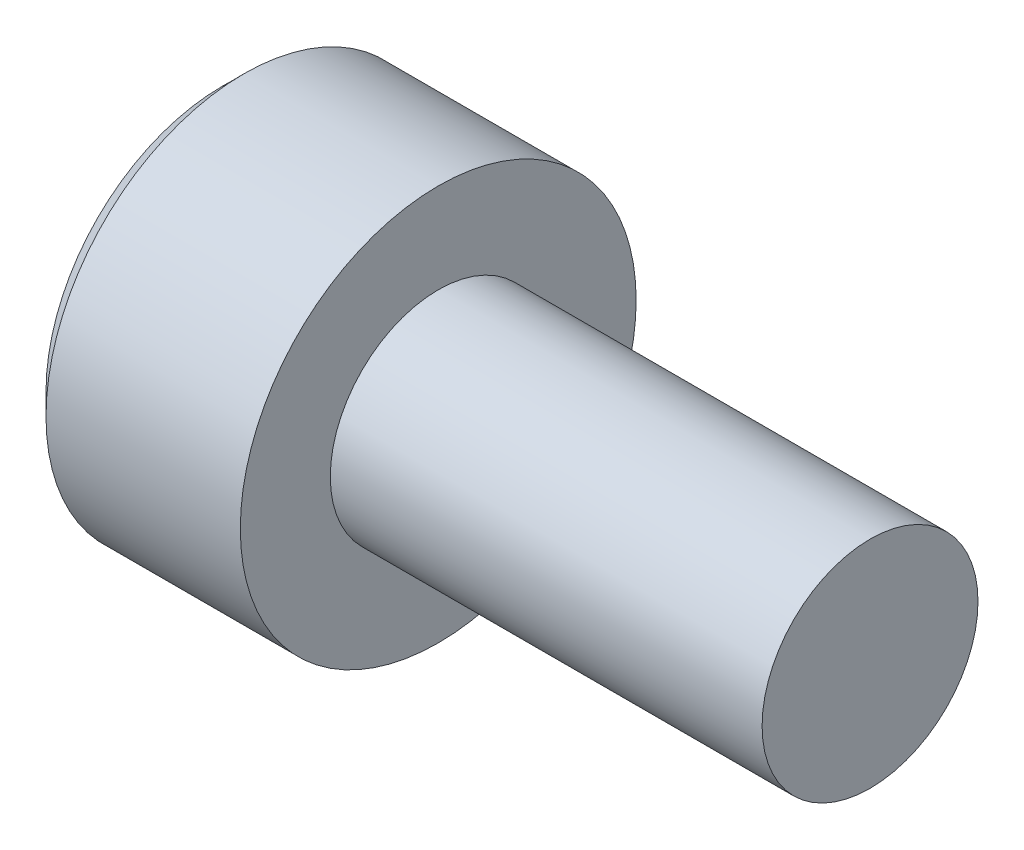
SolidWorks part; units mm, degrees
ref_plane "Front Plane" through (0, 0, 0) normal (0, 0, 1) x (1, 0, 0)
ref_plane "Top Plane" through (0, 0, 0) normal (0, 1, 0) x (1, 0, 0)
ref_plane "Right Plane" through (0, 0, 0) normal (1, 0, 0) x (0, 0, -1)
sketch "Sketch1" plane through (0, 0, 0) normal (0, 0, 1) x (1, 0, 0)
  line L2 (-3, 0) -> (6, 0)
  line L3 (6, 0) -> (6, 1.5)
  line L4 (6, 1.5) -> (0, 1.5)
  line L5 (0, 1.5) -> (0, 2.75)
  line L6 (0, 2.75) -> (-3, 2.75)
  line L7 (-3, 2.75) -> (-3, 0)
  line L8 (-3, 0) -> (6, 0) construction
  line L9 (0, 0) -> (0, 2.75) construction
  dimension "E" = 3
  dimension "L" = 6
  dimension "A" = 5.5
  dimension "M" = 3
revolve "Revolve1" add sketch "Sketch1" about L8
chamfer "Chamfer1" distance 0.3 1 edges at (-3, 0, 2.75)
sketch "Sketch2" plane through (0, 0, 0) normal (0, 0, 1) x (1, 0, 0)
  line L0 (-0.9489, 0) -> (-1.7, 1.25)
  line L1 (-3, 0) -> (6, 0) construction
  line L2 (-1.7, 1.25) -> (-3, 1.25)
  line L3 (-3, 2.75) -> (-3, 0) construction
  line L4 (-3, 1.25) -> (-3, 0)
  line L5 (-3, 0) -> (-0.9489, 0) construction
  line L6 (-0.9489, 0) -> (-3, 0)
  dimension "FIX_3" = 59
revolve "Cut-Revolve1" cut sketch "Sketch2" about L5
sketch "Sketch3" plane through (-3, 0, 0) normal (-1, 0, 0) x (0, 0, 1)
  line L0 (0, -1.4434) -> (0, 1.4434) construction
  line L1 (0, -1.4434) -> (1.25, -0.7217)
  line L2 (1.25, -0.7217) -> (1.25, 0.7217)
  line L3 (1.25, 0.7217) -> (0, 1.4434)
  line L4 (0, 1.4434) -> (-1.25, 0.7217)
  line L5 (-1.25, 0.7217) -> (-1.25, -0.7217)
  line L6 (-1.25, -0.7217) -> (0, -1.4434)
  line L7 (-1.25, 0) -> (1.25, 0) construction
  circle A0 centre (0, 0) radius 1.25 construction
extrude "Cut-Extrude1" cut sketch "Sketch3" against normal blind 1.3
